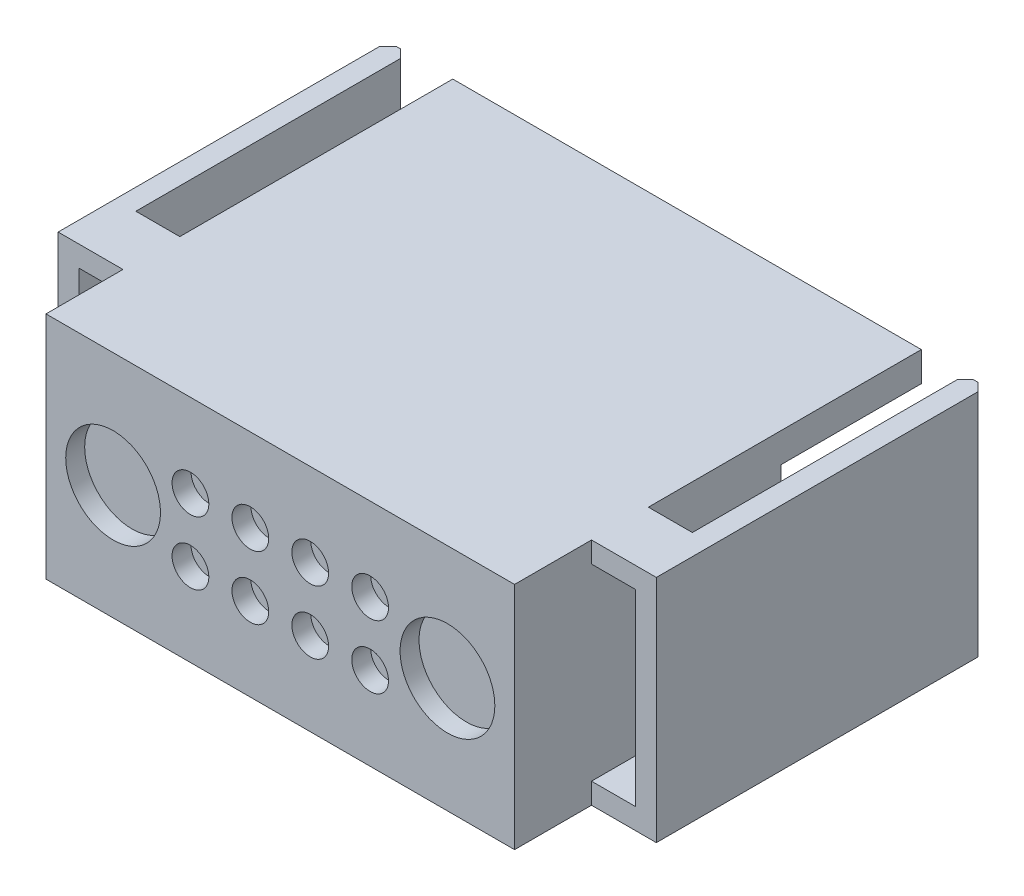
SolidWorks part; units mm, degrees
ref_plane "Front Plane" through (0, 0, 0) normal (0, 0, 1) x (1, 0, 0)
ref_plane "Top Plane" through (0, 0, 0) normal (0, 1, 0) x (1, 0, 0)
ref_plane "Right Plane" through (0, 0, 0) normal (1, 0, 0) x (0, 0, -1)
sketch "Sketch1" plane through (0, 0, 0) normal (0, 1, 0) x (1, 0, 0)
  line L0 (15.6972, 0) -> (-15.6972, 0)
  line L1 (-15.6972, 0) -> (-15.6972, 5.1562)
  line L2 (-15.6972, 5.1562) -> (-20.0406, 5.1562)
  line L3 (-20.0406, 5.1562) -> (-20.0406, 17.8562)
  line L4 (-18.6436, 17.8562) -> (-18.6436, 8.9662)
  line L5 (-18.6436, 8.9662) -> (-15.6972, 8.9662)
  line L6 (-15.6972, 8.9662) -> (-15.6972, 17.8562)
  line L7 (18.6436, 17.8562) -> (20.0406, 17.8562)
  line L8 (-15.6972, 17.8562) -> (15.6972, 17.8562)
  line L9 (-18.6436, 17.8562) -> (-20.0406, 17.8562)
  line L11 (0, 0) -> (0, 19.9739) construction
  line L12 (15.6972, 0) -> (15.6972, 5.1562)
  line L16 (15.6972, 8.9662) -> (15.6972, 17.8562)
  line L17 (18.6436, 8.9662) -> (15.6972, 8.9662)
  line L18 (18.6436, 17.8562) -> (18.6436, 8.9662)
  line L19 (20.0406, 5.1562) -> (20.0406, 17.8562)
  line L20 (15.6972, 5.1562) -> (20.0406, 5.1562)
  point P15 (0, 17.8562)
  dimension "D1" = 1.397
  dimension "D2" = 3.81
  dimension "D3" = 2.9464
  dimension "D4" = 4.3434
  dimension "D5" = 18.6436
  dimension "D6" = 5.1562
extrude "Extrude1" add sketch "Sketch1" along normal mid plane 15.3924
sketch "Sketch2" plane through (0, 0, -8.9662) normal (0, 0, -1) x (-1, 0, 0)
  line L0 (15.6972, 6.2992) -> (18.6436, 6.2992)
  line L1 (15.6972, -6.2992) -> (18.6436, -6.2992)
  line L2 (15.6972, 7.6962) -> (18.6436, 7.6962) construction
  line L3 (15.6972, -7.6962) -> (18.6436, -7.6962) construction
  line L4 (15.6972, -7.6962) -> (18.6436, -7.6962)
  line L5 (18.6436, -7.6962) -> (18.6436, 7.6962)
  line L6 (18.6436, 7.6962) -> (15.6972, 7.6962)
  line L7 (15.6972, 7.6962) -> (15.6972, -7.6962)
  line L8 (0, 0) -> (0, -14.1251) construction
  line L9 (18.6436, -6.2992) -> (18.6436, 6.2992)
  line L10 (-15.6972, 6.2992) -> (-15.6972, -6.2992)
  line L11 (15.6972, 6.2992) -> (15.6972, -6.2992)
  line L12 (-18.6436, -6.2992) -> (-18.6436, 6.2992)
  line L13 (-15.6972, -6.2992) -> (-18.6436, -6.2992)
  line L14 (-15.6972, 6.2992) -> (-18.6436, 6.2992)
  point P8 (17.1704, 7.6962)
  dimension "D2" = 1.397
  dimension "D3" = 1.397
  dimension "D1" = 0
extrude "Cut-Extrude1" cut sketch "Sketch2" against normal blind 3.81
sketch "Sketch3" plane through (0, 0, -17.8562) normal (0, 0, -1) x (-1, 0, 0)
  line L0 (15.6972, 5.715) -> (1.397, 5.715)
  line L1 (15.6972, 7.6962) -> (15.6972, -7.6962) construction
  line L2 (1.397, 5.715) -> (0, 4.318)
  line L3 (0, 4.318) -> (-1.397, 5.715)
  line L4 (-1.397, 5.715) -> (-15.6972, 5.715)
  line L5 (-15.6972, 7.6962) -> (-15.6972, -7.6962) construction
  line L6 (-15.6972, -7.6962) -> (15.6972, -7.6962) construction
  line L7 (-15.6972, -3.937) -> (-13.9192, -5.715)
  line L8 (-13.9192, -5.715) -> (13.9192, -5.715)
  line L9 (13.9192, -5.715) -> (15.6972, -3.937)
  line L10 (-15.6972, 7.6962) -> (15.6972, 7.6962) construction
  line L12 (20.0406, 7.6962) -> (20.0406, -7.6962) construction
  line L13 (-15.6972, -7.6962) -> (15.6972, -7.6962)
  line L14 (-15.6972, 7.6962) -> (15.6972, 7.6962)
  line L15 (15.6972, 7.6962) -> (15.6972, 5.715)
  line L16 (-15.6972, 7.6962) -> (-15.6972, 5.715)
  line L17 (-15.6972, -3.937) -> (-15.6972, -7.6962)
  line L18 (15.6972, -3.937) -> (15.6972, -7.6962)
  dimension "D1" = 90
  dimension "D2" = 45
  dimension "D3" = 5.715
  dimension "D4" = 11.43
  dimension "D5" = 11.43
  dimension "D6" = 20.0406
  dimension "D7" = 1.397
  dimension "D8" = 1.778
  dimension "D9" = 1.778
extrude "Extrude2" add sketch "Sketch3" along normal blind 9.398
sketch "Sketch4" plane through (0, 7.6962, 0) normal (0, 1, 0) x (1, 0, 0)
  line L0 (-20.0406, 17.8562) -> (-18.6436, 17.8562)
  line L1 (-18.6436, 17.8562) -> (-18.6436, 26.7081)
  line L2 (-19.1897, 27.2542) -> (-19.4945, 27.2542)
  line L3 (-20.0406, 17.8562) -> (-20.0406, 26.7081)
  line L4 (-19.4945, 27.2542) -> (-20.0406, 26.7081)
  line L5 (-19.1897, 27.2542) -> (-18.6436, 26.7081)
  line L6 (-19.3421, 27.2542) -> (-19.3421, 26.9152) construction
  line L7 (0, 0) -> (0, 29.6966) construction
  line L8 (19.3421, 27.2542) -> (19.3421, 26.9152) construction
  line L9 (19.1897, 27.2542) -> (18.6436, 26.7081)
  line L10 (19.4945, 27.2542) -> (20.0406, 26.7081)
  line L11 (20.0406, 17.8562) -> (20.0406, 26.7081)
  line L12 (19.1897, 27.2542) -> (19.4945, 27.2542)
  line L13 (18.6436, 17.8562) -> (18.6436, 26.7081)
  line L14 (20.0406, 17.8562) -> (18.6436, 17.8562)
  dimension "D1" = 0.1524
  dimension "D2" = 0.3048
  dimension "D3" = 45
  dimension "D4" = 45
  dimension "D5" = 0.6985
  dimension "D6" = 0.5461
  dimension "D7" = 9.398
extrude "Extrude3" add sketch "Sketch4" against normal blind 15.3924
sketch "Sketch5" plane through (0, 0, -17.8562) normal (0, 0, -1) x (-1, 0, 0)
  line L0 (15.6972, 7.6962) -> (-15.6972, 7.6962) construction
  line L1 (0, 0) -> (0, -11.7178) construction
  circle A0 centre (11.2014, 0) radius 2.6416
  circle A1 centre (-11.2014, 0) radius 2.6416
  circle A2 centre (-6.0198, 2.1209) radius 1.2954
  circle A3 centre (-2.0066, 2.1209) radius 1.2954
  circle A4 centre (2.0066, 2.1209) radius 1.2954
  circle A5 centre (6.0198, 2.1209) radius 1.2954
  circle A6 centre (-6.0198, -2.1209) radius 1.2954
  circle A7 centre (-2.0066, -2.1209) radius 1.2954
  circle A8 centre (2.0066, -2.1209) radius 1.2954
  circle A9 centre (6.0198, -2.1209) radius 1.2954
  dimension "D1" = 5.2832
  dimension "D4" = 2.5908
  dimension "D6" = 2.1209
  dimension "D2" = 7.6962
  dimension "D3" = 11.2014
  dimension "D5" = 6.0198
extrude "Cut-Extrude2" cut sketch "Sketch5" against normal blind 1.27
sketch "Sketch6" plane through (0, 0, 0) normal (0, 0, 1) x (1, 0, 0)
  line L0 (-15.6972, 7.6962) -> (15.6972, 7.6962) construction
  line L1 (0, 0) -> (0, 11.1514) construction
  circle A0 centre (11.2014, 0) radius 3.175
  circle A1 centre (-11.2014, 0) radius 3.175
  circle A2 centre (6.0198, 2.1209) radius 1.2319
  circle A3 centre (2.0066, 2.1209) radius 1.2319
  circle A4 centre (-2.0066, 2.1209) radius 1.2319
  circle A5 centre (-6.0198, 2.1209) radius 1.2319
  circle A6 centre (6.0198, -2.1209) radius 1.2319
  circle A7 centre (2.0066, -2.1209) radius 1.2319
  circle A8 centre (-2.0066, -2.1209) radius 1.2319
  circle A9 centre (-6.0198, -2.1209) radius 1.2319
  dimension "D1" = 6.35
  dimension "D4" = 2.4638
  dimension "D6" = 6.0198
  dimension "D2" = 7.6962
  dimension "D3" = 11.2014
  dimension "D5" = 2.1209
extrude "Cut-Extrude3" cut sketch "Sketch6" against normal blind 1.27
